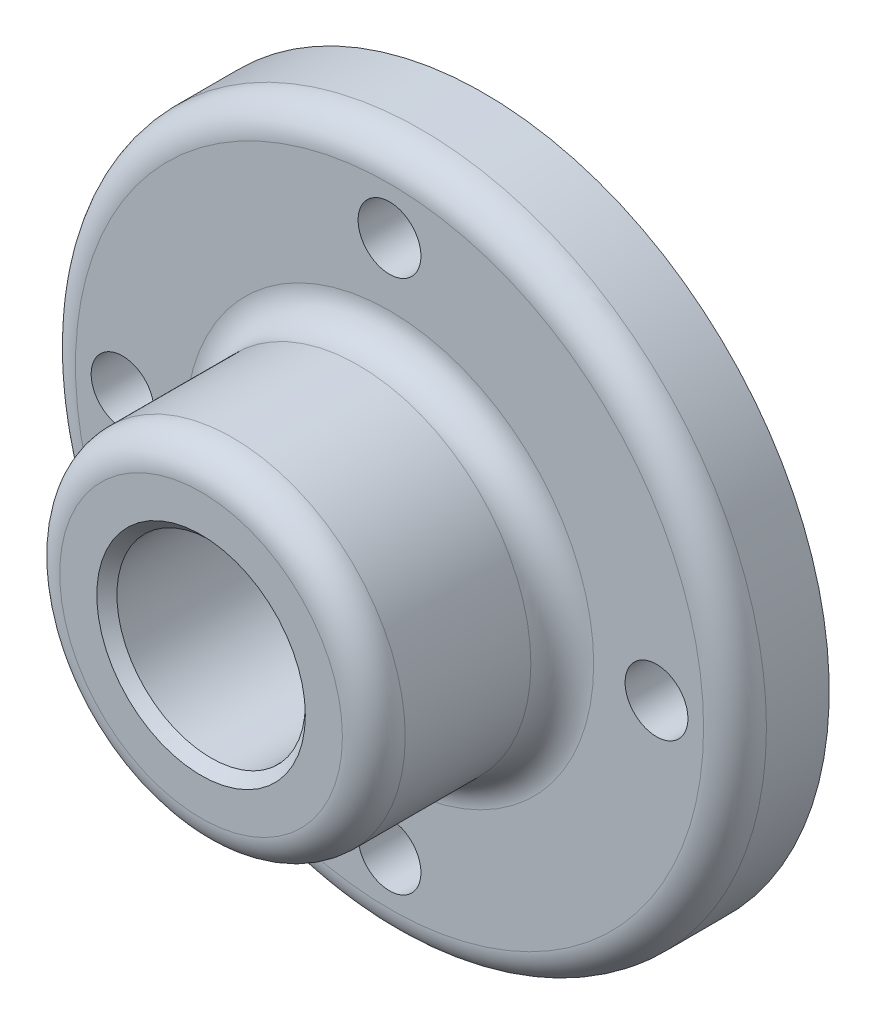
SolidWorks part; units mm, degrees
ref_plane "Front Plane" through (0, 0, 0) normal (0, 0, 1) x (1, 0, 0)
ref_plane "Top Plane" through (0, 0, 0) normal (0, 1, 0) x (1, 0, 0)
ref_plane "Right Plane" through (0, 0, 0) normal (1, 0, 0) x (0, 0, -1)
sketch "Sketch1" plane through (0, 0, 0) normal (0, 0, 1) x (1, 0, 0)
  circle A0 centre (0, 0) radius 69.85
  dimension "D1" = 139.7
extrude "Extrude1" add sketch "Sketch1" along normal blind 19.05
ref_plane "Plane1" through (0, 0, 57.15) normal (0, 0, 1) x (1, 0, 0)
sketch "Sketch2" plane through (0, 0, 57.15) normal (0, 0, 1) x (1, 0, 0)
  circle A0 centre (0, 0) radius 34.925
  dimension "D1" = 69.85
extrude "Extrude2" add sketch "Sketch2" against normal up to next
sketch "Sketch4" plane through (0, 0, 57.15) normal (0, 0, 1) x (1, 0, 0)
  circle A0 centre (0, 0) radius 19.05
  dimension "D1" = 38.1
extrude "Cut-Extrude1" cut sketch "Sketch4" against normal through all
sketch "Sketch5" plane through (0, 0, 19.05) normal (0, 0, 1) x (1, 0, 0)
  circle A0 centre (0, 0) radius 53.975 construction
  circle A1 centre (0, 53.975) radius 6.35
  dimension "D1" = 107.95
  dimension "D2" = 12.7
extrude "Cut-Extrude2" cut sketch "Sketch5" against normal through all
pattern_circular "CirPattern1" count 4 over 360 about axis through (0, 0, 0) along (0, 0, 1) of "Cut-Extrude2"
fillet "Fillet1" radius 6.35 3 edges at (34.925, 0, 57.15) (34.925, 0, 19.05) (69.85, 0, 19.05)
chamfer "Chamfer1" distance 2.032 angle 45 1 edges at (19.05, 0, 57.15)
sketch "Sketch6" plane through (0, 0, 0) normal (1, 0, 0) x (0, 0, -1)
  circle A0 centre (-23.4176, -10.327) radius 67.6963
